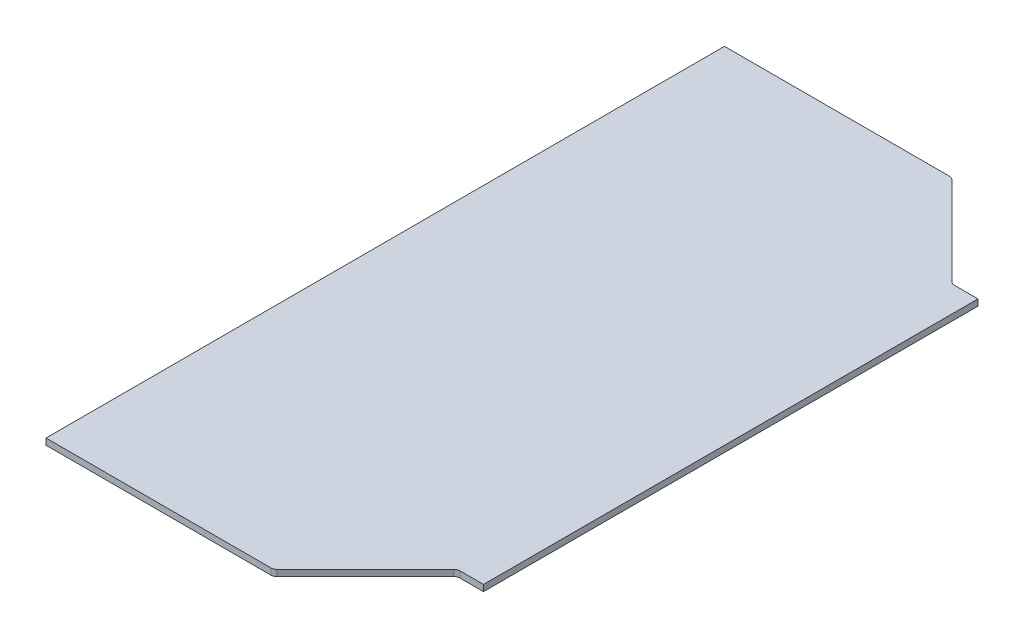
SolidWorks part; units mm, degrees
ref_plane "Front Plane" through (0, 0, 0) normal (0, 0, 1) x (1, 0, 0)
ref_plane "Top Plane" through (0, 0, 0) normal (0, 1, 0) x (1, 0, 0)
ref_plane "Right Plane" through (0, 0, 0) normal (1, 0, 0) x (0, 0, -1)
sketch "Sketch1" plane through (0, 0, 0) normal (0, 1, 0) x (1, 0, 0)
  line L1 (0, 0) -> (774.7, 0)
  line L2 (0, 0) -> (0, 1371.6)
  line L3 (0, 1371.6) -> (774.7, 1371.6)
  line L4 (774.7, 0) -> (774.7, 1371.6)
  dimension "D1" = 1371.6
  dimension "D2" = 774.7
extrude "Extrude1" add sketch "Sketch1" against normal blind 12.7
sketch "Sketch2" plane through (0, 0, 0) normal (0, 1, 0) x (1, 0, 0)
  line L0 (459.74, 0) -> (645.668, 185.928)
  line L1 (0, 0) -> (774.7, 0) construction
  line L2 (645.668, 185.928) -> (774.7, 185.928)
  line L3 (774.7, 0) -> (774.7, 1371.6) construction
  line L4 (0, 1371.6) -> (0, 0) construction
  line L5 (459.74, 0) -> (774.7, 0)
  line L6 (774.7, 0) -> (774.7, 185.928)
  line L7 (0, 685.8) -> (864.1899, 685.8) construction
  line L8 (459.74, 1371.6) -> (645.668, 1185.672)
  line L9 (645.668, 1185.672) -> (774.7, 1185.672)
  line L10 (774.7, 1371.6) -> (774.7, 1185.672)
  line L11 (459.74, 1371.6) -> (774.7, 1371.6)
  dimension "D1" = 459.74
  dimension "D2" = 185.928
  dimension "D3" = 45
extrude "Extrude2" cut sketch "Sketch2" against normal through all
fillet "Fillet1" radius 12.7 6 edges at (459.74, -6.35, 0) (645.668, -6.35, -185.928) (774.7, -6.35, -185.928) (774.7, -6.35, -1185.672) (645.668, -6.35, -1185.672) (459.74, -6.35, -1371.6)
sketch "Sketch3" plane through (0, -12.7, 0) normal (0, -1, 0) x (1, 0, 0)
  line L0 (774.7, -198.628) -> (774.7, -1172.972) construction
  line L1 (899.1023, -138.3551) -> (698.5, -138.3551)
  line L2 (899.1023, -138.3551) -> (899.1023, -1209.6158)
  line L3 (899.1023, -1209.6158) -> (698.5, -1209.6158)
  line L4 (698.5, -138.3551) -> (698.5, -1209.6158)
  dimension "D1" = 76.2
extrude "Extrude3" cut sketch "Sketch3" against normal through all
